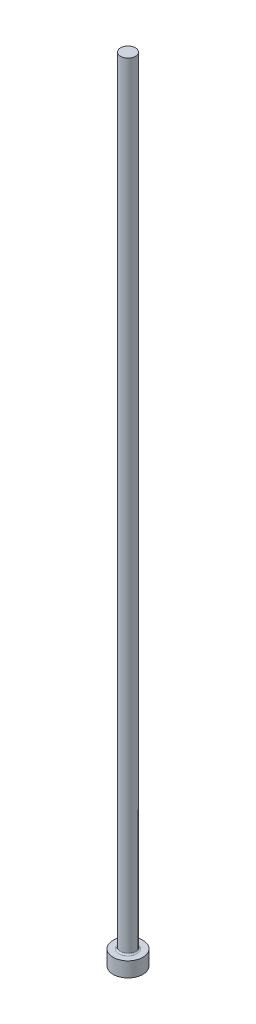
SolidWorks part; units mm, degrees
ref_plane "Plano frontal" through (0, 0, 0) normal (0, 0, 1) x (1, 0, 0)
ref_plane "Plano superior" through (0, 0, 0) normal (0, 1, 0) x (1, 0, 0)
ref_plane "Plano direito" through (0, 0, 0) normal (1, 0, 0) x (0, 0, -1)
sketch "Esboço1" plane through (0, 0, 0) normal (0, 0, 1) x (1, 0, 0)
  line L0 (0, 0) -> (3, 0)
  line L1 (3, 0) -> (3, 3)
  line L2 (3, 3) -> (1.8, 3)
  line L3 (1.5, 3.3) -> (1.5, 160)
  line L4 (1.5, 160) -> (0, 160)
  line L5 (0, 160) -> (0, 0) construction
  line L6 (0, 0) -> (0, 160)
  arc A0 (1.8, 3) -> (1.5, 3.3) centre (1.8, 3.3) cw
  dimension "D3" = 0.3
  dimension "D1" = 6
  dimension "D2" = 3
  dimension "D4" = 3
  dimension "D5" = 160
revolve "Revolução1" add sketch "Esboço1" angle 360 about L5
sketch "Esboço2"
  dimension "D1" = 1.6125
  dimension "D2" = 0.3375
  dimension "D3" = 0.525
  dimension "D4" = 0.225
wrap "Envolver1" sketch "Esboço2" wrap type deboss source sketch "Esboço2" thickness 0.1 parameters "D1"=0.1
